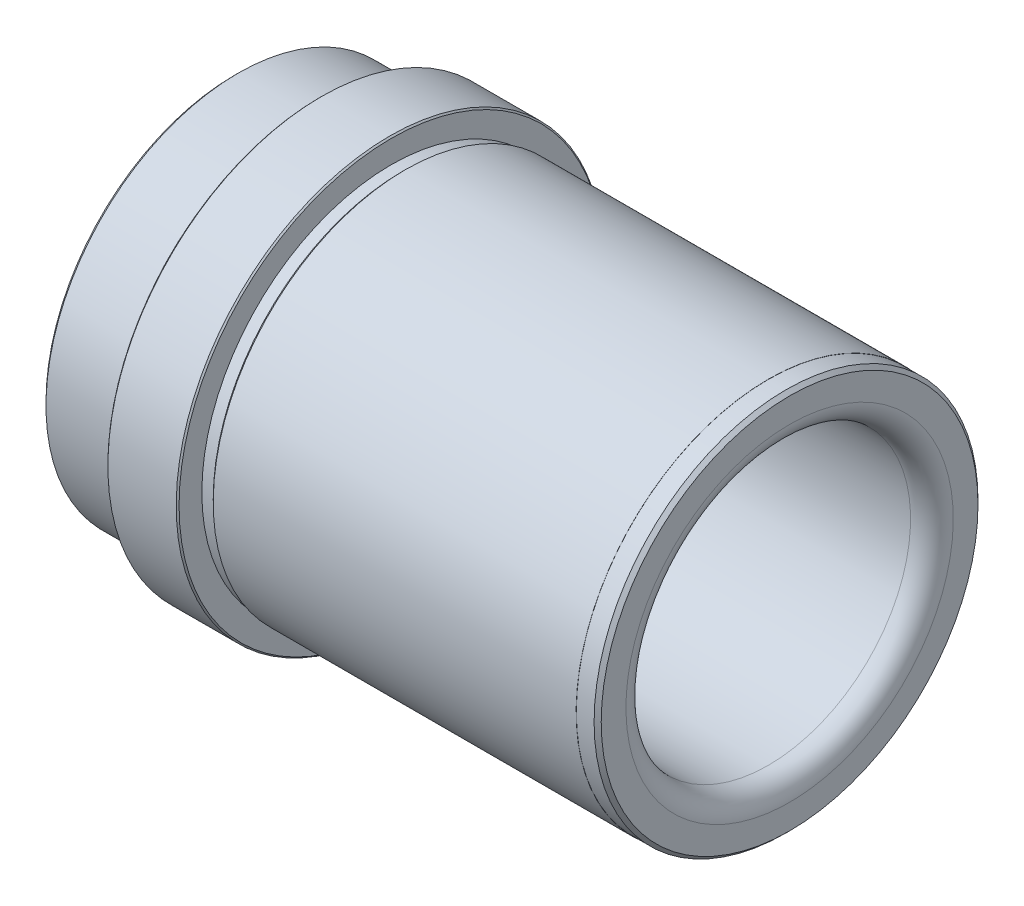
SolidWorks part; units mm, degrees
ref_plane "Front Plane" through (0, 0, 0) normal (0, 0, 1) x (1, 0, 0)
ref_plane "Top Plane" through (0, 0, 0) normal (0, 1, 0) x (1, 0, 0)
ref_plane "Right Plane" through (0, 0, 0) normal (1, 0, 0) x (0, 0, -1)
sketch "Sketch1" plane through (0, 0, 0) normal (0, 0, 1) x (1, 0, 0)
  line L0 (-22, 30) -> (-22, 26.6) construction
  line L1 (36, 27) -> (-15, 27)
  line L2 (-27, 26.6) -> (-28.6, 26.6)
  line L3 (-28.6, 26.6) -> (-29, 27)
  line L4 (39, 26.975) -> (36, 26.975)
  line L5 (36, 26.975) -> (36, 27)
  line L6 (-17, 30) -> (-17, 26.6)
  line L7 (-17, 30) -> (-27, 30)
  line L8 (-27, 26.6) -> (-27, 30)
  line L11 (-29, 27) -> (-39, 27)
  line L12 (-39, 27) -> (-39, 0)
  line L13 (39, 26.975) -> (39, 0)
  line L14 (39, 0) -> (-39, 0) construction
  line L15 (39, 0) -> (-39, 0)
  line L16 (-15, 27) -> (-15.4, 26.6)
  line L17 (-15.4, 26.6) -> (-17, 26.6)
  point P0 (0, 0)
  point P16 (0, 0)
  dimension "D5" = 2
  dimension "D1" = 135
  dimension "D2" = 135
  dimension "PinDia" = 54
  dimension "D3" = 0.4
  dimension "D4" = 2
  dimension "T" = 10
  dimension "CollarLength" = 12
  dimension "HeadDia" = 60
  dimension "D6" = 0.025
  dimension "S" = 66
  dimension "LeadLength" = 3
revolve "Revolve1" add sketch "Sketch1" angle 360 about L14
sketch "Sketch2" plane through (39, 0, 0) normal (1, 0, 0) x (0, 0, -1)
  circle A0 centre (0, 0) radius 20
  circle A1 centre (0, 0) radius 27 construction
  dimension "ID" = 40
extrude "Extrude1" cut sketch "Sketch2" against normal blind 116
sketch "Sketch3" [suppressed] plane through (-52, 0, 0) normal (1, 0, 0) x (0, 0, -1)
  circle A2 centre (0, 0) radius 21.01
  circle A3 centre (0, 0) radius 21.01
  dimension "D1" = 0.01
extrude "Extrude2" [suppressed] cut sketch "Sketch3" against normal through all
fillet "Fillet2" radius 3 1 edges at (39, 20, 0)
chamfer "Chamfer3" distance 0.5 angle 45 1 edges at (39, 26.975, 0)
chamfer "Chamfer4" distance 0.2 angle 45 2 edges at (-27, 30, 0) (-17, 30, 0)
chamfer "Chamfer5" distance 0.5 angle 45 2 edges at (-39, 27, 0) (-39, -20, 0)
chamfer "Chamfer6" [suppressed] distance 0.5 angle 45
